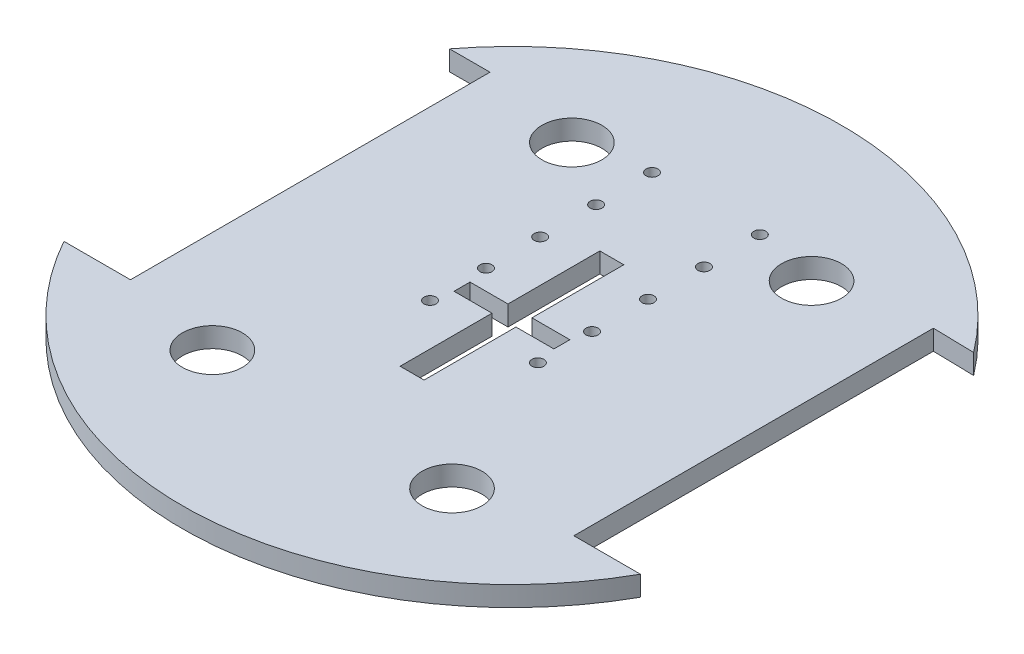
SolidWorks part; units mm, degrees
ref_plane "Front Plane" through (0, 0, 0) normal (0, 0, 1) x (1, 0, 0)
ref_plane "Top Plane" through (0, 0, 0) normal (0, 1, 0) x (1, 0, 0)
ref_plane "Right Plane" through (0, 0, 0) normal (1, 0, 0) x (0, 0, -1)
sketch "Sketch1" plane through (0, 0, 0) normal (0, 1, 0) x (1, 0, 0)
  circle A0 centre (0, 0) radius 82.5
  dimension "D1" = 165
extrude "Boss-Extrude1" add sketch "Sketch1" against normal blind 5
sketch "Sketch3" plane through (0, -5, 0) normal (0, -1, 0) x (-1, 0, 0)
  line L2 (55.5, 50) -> (55.5, -40)
  line L5 (65.622, 50) -> (55.5, 50)
  line L6 (72.1543, -40) -> (55.5, -40)
  line L9 (-55.5, 50) -> (-55.5, -40)
  line L10 (-72.1543, -40) -> (-55.5, -40)
  line L12 (-65.7929, 49.7749) -> (-55.5, 50)
  circle A0 centre (0, 0) radius 82.5 construction
  arc A1 (-65.7929, 49.7749) -> (-72.1543, -40) centre (0, 0) ccw
  arc A2 (72.1543, -40) -> (65.622, 50) centre (0, 0) ccw
  dimension "D3" = 90
  dimension "D2" = 90
  dimension "D1" = 90
extrude "Cut-Extrude1" cut sketch "Sketch3" against normal through all
sketch "Sketch4" plane through (0, -5, 0) normal (0, -1, 0) x (-1, 0, 0)
  line L0 (-13.5, -28.259) -> (-13.5, 69.3678) construction
  line L1 (-55.5, -40) -> (-55.5, 50) construction
  line L2 (13.5, -7) -> (13.5, 63.9409) construction
  line L3 (0, 0) -> (-69.4841, 0) construction
  line L4 (55.5, 50) -> (55.5, -40) construction
  circle A0 centre (13.5, -7) radius 1.5
  circle A2 centre (13.5, 7) radius 1.5
  circle A3 centre (-13.5, 6.5544) radius 1.5
  circle A4 centre (-13.5, -7) radius 1.5
  circle A5 centre (-13.5, 20.5544) radius 1.5
  circle A6 centre (13.5, 20.5544) radius 1.5
  circle A7 centre (-13.5, 34.5544) radius 1.5
  circle A8 centre (-13.5, 48.5544) radius 1.5
  circle A9 centre (13.5, 48.5544) radius 1.5
  circle A10 centre (13.5, 34.5544) radius 1.5
  dimension "D1" = 3
  dimension "D2" = 14
  dimension "D3" = 42
  dimension "D4" = 42
  dimension "D6" = 42
extrude "Cut-Extrude2" cut sketch "Sketch4" against normal through all
sketch "Sketch5" plane through (0, -5, 0) normal (0, -1, 0) x (-1, 0, 0)
  circle A0 centre (30, -45) radius 7.5
  circle A1 centre (-30, -45) radius 7.5
  circle A2 centre (30, 45) radius 7.5
  circle A3 centre (-30, 45) radius 7.5
  dimension "D1" = 15
extrude "Cut-Extrude3" cut sketch "Sketch5" against normal through all
sketch "Sketch6" plane through (0, -5, 0) normal (0, -1, 0) x (-1, 0, 0)
  line L5 (3, 25) -> (-3, 25)
  line L6 (3, 25) -> (3, -25)
  line L7 (3, -25) -> (-3, -25)
  line L8 (-3, 25) -> (-3, -25)
  point P0 (0, 0)
  point P1 (0, 0)
  dimension "D1" = 6
  dimension "D2" = 50
extrude "Cut-Extrude4" cut sketch "Sketch6" against normal through all
sketch "Sketch7" plane through (0, -5, 0) normal (0, -1, 0) x (-1, 0, 0)
  line L5 (-12.5, 2) -> (12.5, 2)
  line L6 (-12.5, 2) -> (-12.5, -2)
  line L7 (-12.5, -2) -> (12.5, -2)
  line L8 (12.5, 2) -> (12.5, -2)
  point P0 (0, 0)
  point P1 (0, 0)
  dimension "D1" = 25
  dimension "D2" = 4
extrude "Cut-Extrude5" cut sketch "Sketch7" against normal through all
